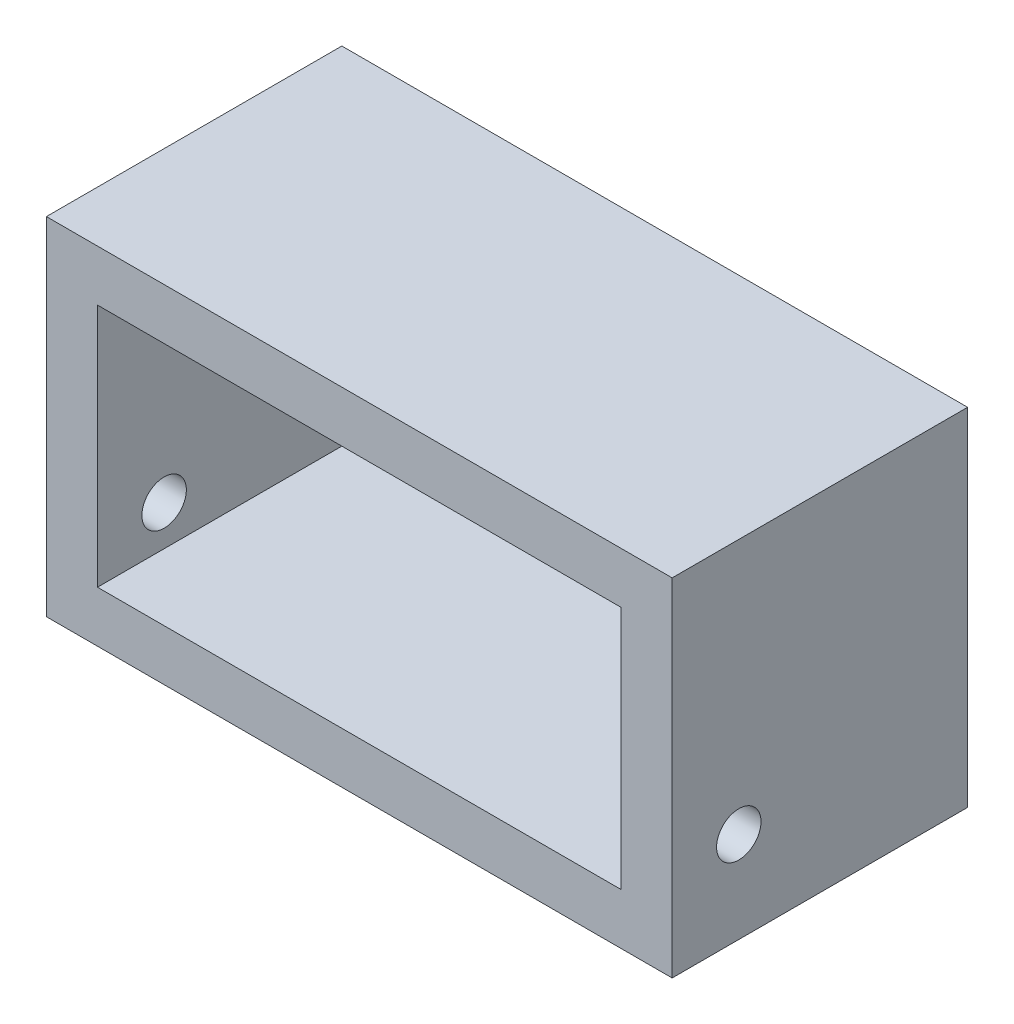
SolidWorks part; units mm, degrees
ref_plane "Plan de face" through (0, 0, 0) normal (0, 0, 1) x (1, 0, 0)
ref_plane "Plan de dessus" through (0, 0, 0) normal (0, 1, 0) x (1, 0, 0)
ref_plane "Plan de droite" through (0, 0, 0) normal (1, 0, 0) x (0, 0, -1)
sketch "Esquisse1" plane through (0, 0, 0) normal (0, 0, 1) x (1, 0, 0)
  line L1 (117.85, -55) -> (-117.85, -55)
  line L2 (117.85, -55) -> (117.85, 55)
  line L3 (117.85, 55) -> (-117.85, 55)
  line L4 (-117.85, -55) -> (-117.85, 55)
  line L5 (117.85, -55) -> (-117.85, 55) construction
  line L6 (117.85, 55) -> (-117.85, -55) construction
  point P0 (0, 0)
  dimension "D1" = 110
  dimension "D2" = 235.7
extrude "Boss.-Extru.1" add sketch "Esquisse1" against normal blind 110
shell "Coque1" thickness 23
sketch "Esquisse2" plane through (-140.85, 0, 0) normal (-1, 0, 0) x (0, 0, 1)
  line L0 (0, 78) -> (0, -78) construction
  circle A0 centre (-30, -37) radius 10
  dimension "D1" = 20
  dimension "D2" = 18
  dimension "D3" = 30
extrude "Enlèv. mat.-Extru.1" cut sketch "Esquisse2" against normal through all
sketch "Esquisse3" plane through (0, 0, 0) normal (0, 0, 1) x (1, 0, 0)
  line L2 (-117.85, 55) -> (117.85, 55)
  line L3 (-117.85, 55) -> (-117.85, -55)
  line L4 (-117.85, -55) -> (117.85, -55)
  line L9 (117.85, 55) -> (117.85, -55)
extrude "Enlèv. mat.-Extru.2" cut sketch "Esquisse3" against normal through all
chamfer "Chanfrein2" distance 23 angle 45 1 edges at (0, -55, -133)
sketch "Esquisse5" plane through (0, 27.5, -27.5) normal (0, 0.7071, -0.7071) x (1, 0, 0)
  line L0 (117.85, 132.9361) -> (107.65, 132.9361) construction
  line L1 (117.85, 149.1995) -> (117.85, 116.6726) construction
  circle A0 centre (107.65, 132.9361) radius 4
  dimension "D1" = 8
  dimension "D2" = 10.2
extrude "Enlèv. mat.-Extru.4" cut sketch "Esquisse5" against normal blind 110
mirror "Symétrie2" about plane through (0, 0, 0) normal (1, 0, 0) of "Enlèv. mat.-Extru.4"
